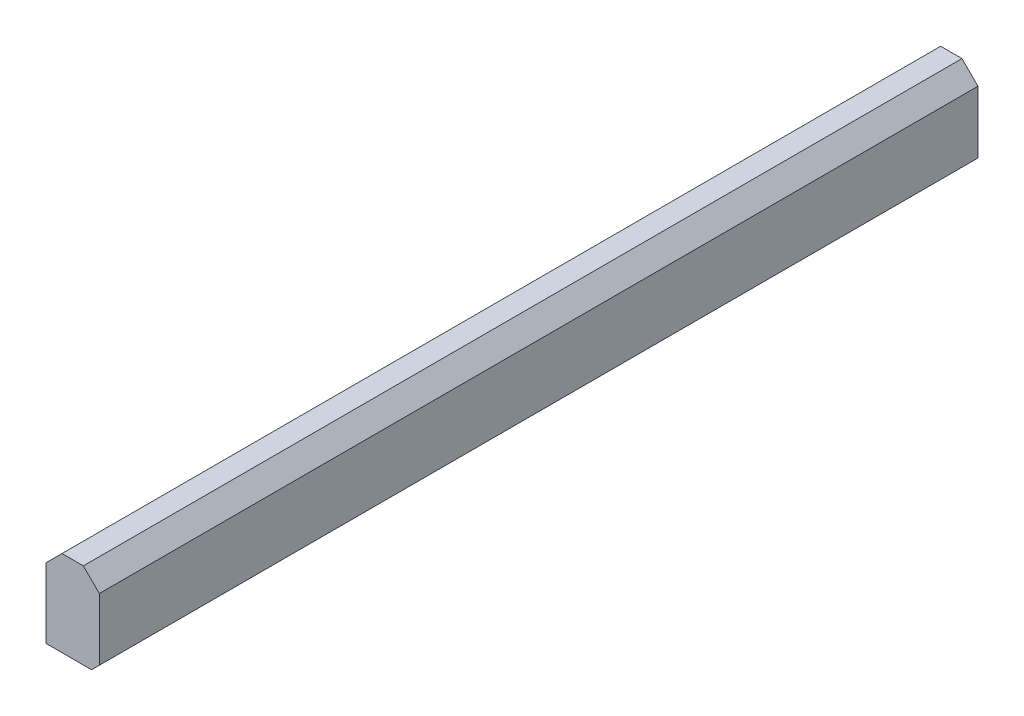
SolidWorks part; units mm, degrees
ref_plane "Front Plane" through (0, 0, 0) normal (1, 0, 0) x (0, 1, 0)
ref_plane "Top Plane" through (0, 0, 0) normal (0, 0, 1) x (0, 1, 0)
ref_plane "Right Plane" through (0, 0, 0) normal (0, 1, 0) x (-1, 0, 0)
sketch "sk w193" plane through (0, 0, 0) normal (0, 0, 1) x (0, 1, 0)
  point P0 (-199.517, -196.596)
  point P2 (0, -196.596)
  point P3 (11.303, 0)
  line B0 (-199.517, -196.596) -> (-199.517, -160.02)
  line B1 (-199.517, -160.02) -> (-26.543, -160.02)
  line B2 (-11.303, -144.78) -> (-11.303, 144.78)
  line B3 (-26.543, 160.02) -> (-199.517, 160.02)
  line B4 (-199.517, 160.02) -> (-199.517, 196.596)
  line B5 (-199.517, 196.596) -> (199.517, 196.596)
  line B6 (199.517, 196.596) -> (199.517, 160.02)
  line B7 (199.517, 160.02) -> (26.543, 160.02)
  line B8 (11.303, 144.78) -> (11.303, -144.78)
  line B9 (26.543, -160.02) -> (199.517, -160.02)
  line B10 (199.517, -160.02) -> (199.517, -196.596)
  line B11 (199.517, -196.596) -> (-199.517, -196.596)
  arc B12 (-26.543, -160.02) -> (-11.303, -144.78) centre (-26.543, -144.78) ccw
  arc B13 (-11.303, 144.78) -> (-26.543, 160.02) centre (-26.543, 144.78) ccw
  arc B14 (26.543, 160.02) -> (11.303, 144.78) centre (26.543, 144.78) ccw
  arc B15 (11.303, -144.78) -> (26.543, -160.02) centre (26.543, -144.78) ccw
sketch_block_instance "w14x193-2"
sketch_block "w14x193" parameters "D4"=15.24, "D1"=399.034, "D2"=393.192, "D3"=22.606, "D5"=36.576
sketch "Sketch2" plane through (0, 0, 0) normal (0, 0, 1) x (0, 1, 0)
  line L1 (-94.107, 58.42) -> (94.107, 58.42)
  line L2 (-94.107, 58.42) -> (-94.107, -58.42)
  line L3 (-94.107, -58.42) -> (94.107, -58.42)
  line L4 (94.107, 58.42) -> (94.107, -58.42)
  line L5 (-94.107, 58.42) -> (94.107, -58.42) construction
  line L6 (-94.107, -58.42) -> (94.107, 58.42) construction
  point P0 (0, 0)
  dimension "D1" = 116.84
  dimension "D2" = 188.214
extrude "Boss-Extrude1" add sketch "Sketch2" along normal mid plane 1925.382
chamfer "Chamfer1" distance 17 angle 45 1 edges at (58.42, -94.107, 0)
chamfer "Chamfer2" distance 35 angle 45 2 edges at (-58.42, 94.107, 0) (58.42, 94.107, 0)
